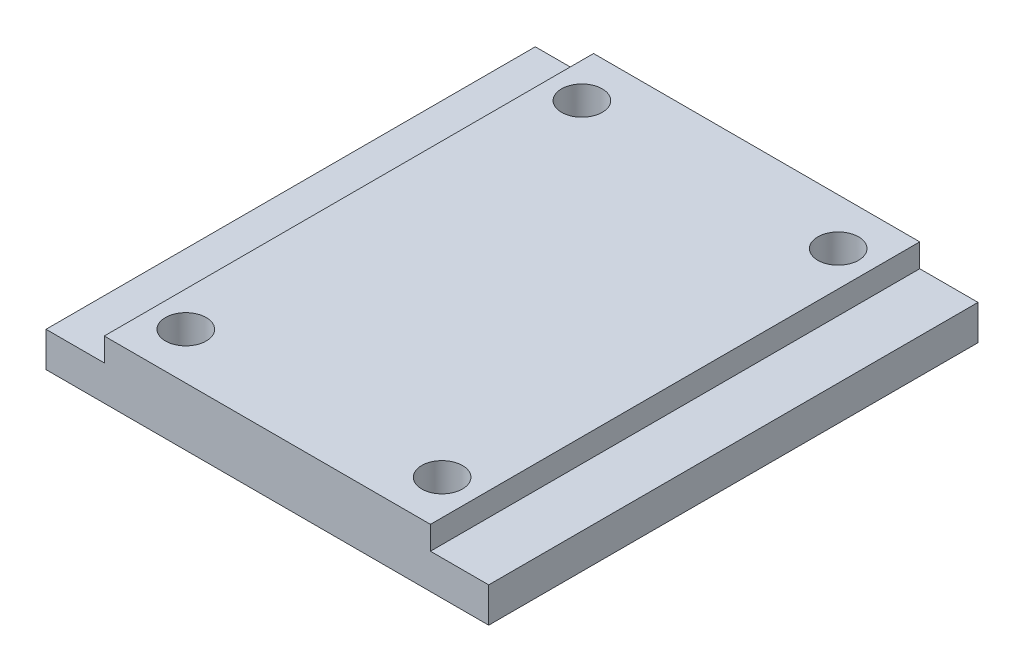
SolidWorks part; units mm, degrees
ref_plane "Plan de face" through (0, 0, 0) normal (0, 0, 1) x (1, 0, 0)
ref_plane "Plan de dessus" through (0, 0, 0) normal (0, 1, 0) x (1, 0, 0)
ref_plane "Plan de droite" through (0, 0, 0) normal (1, 0, 0) x (0, 0, -1)
sketch "Esquisse1" plane through (0, 0, 0) normal (0, 0, 1) x (1, 0, 0)
  line L0 (0, 0) -> (-19, 0)
  line L1 (-19, 0) -> (-19, 3)
  line L2 (-19, 3) -> (-14, 3)
  line L3 (-14, 3) -> (-14, 5)
  line L4 (-14, 5) -> (0, 5)
  line L5 (0, 5) -> (0, 0)
  dimension "D1" = 14
  dimension "2" = 2
  dimension "D3" = 3
  dimension "D4" = 19
extrude "Boss.-Extru.1" add sketch "Esquisse1" along normal mid plane 42
sketch "Esquisse2" plane through (0, 5, 0) normal (0, 1, 0) x (1, 0, 0)
  line L0 (0, -21) -> (-14, -21) construction
  line L1 (-14, -21) -> (-14, 21) construction
  circle A0 centre (-11, -17) radius 1.75
  dimension "D2" = 3.5
  dimension "D1" = 4
  dimension "D3" = 3
extrude "Enlèv. mat.-Extru.1" cut sketch "Esquisse2" against normal through all
sketch "Esquisse3" plane through (0, 0, 0) normal (0, -1, 0) x (1, 0, 0)
  line L1 (-8, 15.2679) -> (-8, 18.7321)
  line L2 (-8, 18.7321) -> (-11, 20.4641)
  line L3 (-11, 20.4641) -> (-14, 18.7321)
  line L4 (-14, 18.7321) -> (-14, 15.2679)
  line L5 (-14, 15.2679) -> (-11, 13.5359)
  line L6 (-11, 13.5359) -> (-8, 15.2679)
  circle A0 centre (-11, 17) radius 3 construction
  dimension "D1" = 6
extrude "Enlèv. mat.-Extru.2" cut sketch "Esquisse3" against normal blind 2.5
mirror "Symétrie1" about plane through (0, 0, 0) normal (0, 0, 1) of "Enlèv. mat.-Extru.2", "Enlèv. mat.-Extru.1"
mirror "Symétrie2" about plane through (0, 5, 21) normal (-1, 0, 0) of "Boss.-Extru.1", "Symétrie1", "Enlèv. mat.-Extru.1", "Enlèv. mat.-Extru.2"
